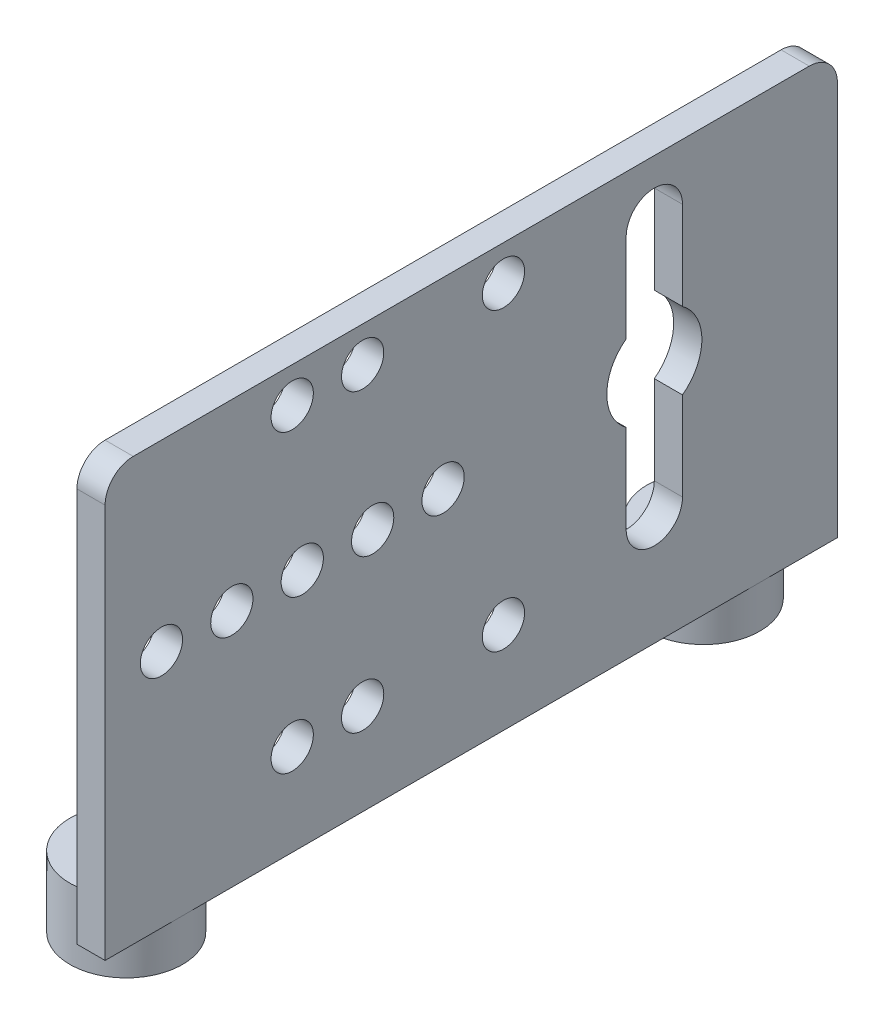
SolidWorks part; units mm, degrees
ref_plane "Alzado" through (0, 0, 0) normal (0, 0, 1) x (1, 0, 0)
ref_plane "Planta" through (0, 0, 0) normal (0, 1, 0) x (1, 0, 0)
ref_plane "Vista lateral" through (0, 0, 0) normal (1, 0, 0) x (0, 0, -1)
sketch "Croquis1" plane through (0, 0, 0) normal (0, 0, 1) x (1, 0, 0)
  line L0 (0, 0) -> (12, 0)
  line L1 (12, 0) -> (12, 3)
  line L2 (12, 3) -> (2, 3)
  line L3 (2, 3) -> (2, 30)
  line L4 (2, 30) -> (0, 30)
  line L5 (0, 30) -> (0, 0)
  dimension "D1" = 12
  dimension "D2" = 30
  dimension "D3" = 3
  dimension "D4" = 2
extrude "Saliente-Extruir1" add sketch "Croquis1" along normal blind 52
sketch "Croquis2" plane through (0, 3, 0) normal (0, 1, 0) x (1, 0, 0)
  line L0 (12, -52) -> (12, 0) construction
  line L1 (12, -4) -> (6.5, -4)
  line L2 (12, -4) -> (12, -7)
  line L3 (12, -7) -> (6.5, -7)
  line L5 (12, 0) -> (2, 0) construction
  line L6 (12, -29) -> (6.5, -29)
  line L7 (12, -29) -> (12, -32)
  line L8 (12, -32) -> (6.5, -32)
  line L9 (12, -44) -> (6.5, -44)
  line L10 (12, -44) -> (12, -47)
  line L11 (12, -47) -> (6.5, -47)
  arc A0 (6.5, -4) -> (6.5, -7) centre (6.5, -5.5) ccw
  arc A1 (6.5, -29) -> (6.5, -32) centre (6.5, -30.5) ccw
  arc A2 (6.5, -44) -> (6.5, -47) centre (6.5, -45.5) ccw
  dimension "D1" = 3
  dimension "D2" = 4
  dimension "D3" = 3
  dimension "D4" = 29
  dimension "D5" = 3
  dimension "D6" = 44
extrude "Cortar-Extruir1" cut sketch "Croquis2" against normal up to surface (3 mm away)
fillet "Redondeo2" radius 2 4 edges at (1, 30, 0) (12, 1.5, 0) (12, 1.5, 52) (1, 30, 52)
sketch "Croquis3" plane through (2, 0, 0) normal (1, 0, 0) x (0, 0, -1)
  line L2 (-52, 3) -> (-52, 28) construction
  line L3 (-52, 3) -> (0, 3) construction
  line L4 (-50, 30) -> (-2, 30) construction
  line L5 (-69.8553, 17) -> (-1.6003, 17) construction
  circle A0 centre (-43, 17) radius 1.5
  circle A1 centre (-38, 17) radius 1.5
  circle A2 centre (-48, 17) radius 1.5
  circle A3 centre (-33, 17) radius 1.5
  circle A4 centre (-28, 17) radius 1.5
  circle A5 centre (-38.7121, 27.5) radius 1.5
  circle A6 centre (-33.7121, 27.5) radius 1.5
  circle A7 centre (-33.7121, 6.5) radius 1.5
  circle A8 centre (-38.7121, 6.5) radius 1.5
  circle A9 centre (-23.7121, 6.5) radius 1.5
  circle A10 centre (-23.7121, 27.5) radius 1.5
  dimension "D1" = 4
  dimension "D2" = 3
  dimension "D5" = 3
  dimension "D6" = 3
  dimension "D7" = 3
  dimension "D8" = 3
  dimension "D13" = 13
  dimension "D12" = 3
  dimension "D15" = 3
  dimension "D19" = 3
  dimension "D3" = 14
  dimension "D4" = 5
  dimension "D9" = 5
  dimension "D10" = 5
  dimension "D11" = 5
  dimension "D14" = 2.5
  dimension "D16" = 5
  dimension "D17" = 5
  dimension "D18" = 15
  dimension "D20" = 15
extrude "Cortar-Extruir2" cut sketch "Croquis3" against normal up to surface (2 mm away)
sketch "Croquis5" plane through (0, 0, 52) normal (0, 0, 1) x (1, 0, 0)
  line L1 (2, 3) -> (12, 3)
  line L2 (2, 3) -> (2, 0)
  line L3 (2, 0) -> (12, 0)
  line L4 (12, 3) -> (12, 0)
extrude "Cortar-Extruir3" cut sketch "Croquis5" against normal through all both and the other way through all
sketch "Croquis6" plane through (0, 0, 0) normal (0, -1, 0) x (1, 0, 0)
  line L0 (1, 0) -> (1, 52) construction
  line L1 (0, 0) -> (2, 0) construction
  line L2 (0, 52) -> (2, 52) construction
  line L3 (2, 0) -> (2, 52) construction
  circle A0 centre (-2, 46.5) radius 4
  dimension "D2" = 8
  dimension "D1" = 5.5
extrude "Saliente-Extruir2" add sketch "Croquis6" along normal blind 5 from offset 2
sketch "Croquis7" plane through (0, -3, 0) normal (0, -1, 0) x (1, 0, 0)
  circle A0 centre (-2, 46.5) radius 3.25
  dimension "D1" = 6.5
extrude "Cortar-Extruir4" cut sketch "Croquis7" against normal blind 3
ref_plane "Plano1" through (0, 0, 26) normal (0, 0, 1) x (1, 0, 0)
mirror "Simetría1" about plane through (0, 0, 26) normal (0, 0, 1) of "Cortar-Extruir4", "Saliente-Extruir2"
sketch "Croquis8" plane through (0, 0, 0) normal (-1, 0, 0) x (0, 0, 1)
  line L0 (28, 17) -> (13, 17) construction
  line L1 (11, 26) -> (11, 19.7186)
  line L2 (15, 26) -> (15, 19.7186)
  line L3 (15, 8) -> (15, 14.2814)
  line L4 (11, 8) -> (11, 14.2814)
  arc A0 (11, 19.7186) -> (11, 14.2814) centre (13, 17) ccw
  circle A2 centre (28, 17) radius 1.5 construction
  arc A3 (15, 26) -> (11, 26) centre (13, 26) ccw
  arc A4 (15, 8) -> (11, 8) centre (13, 8) cw
  arc A5 (15, 14.2814) -> (15, 19.7186) centre (13, 17) ccw
  dimension "D1" = 6.75
  dimension "D2" = 15
  dimension "D3" = 4
  dimension "D4" = 9
extrude "Cortar-Extruir5" cut sketch "Croquis8" against normal through all both and the other way through all
